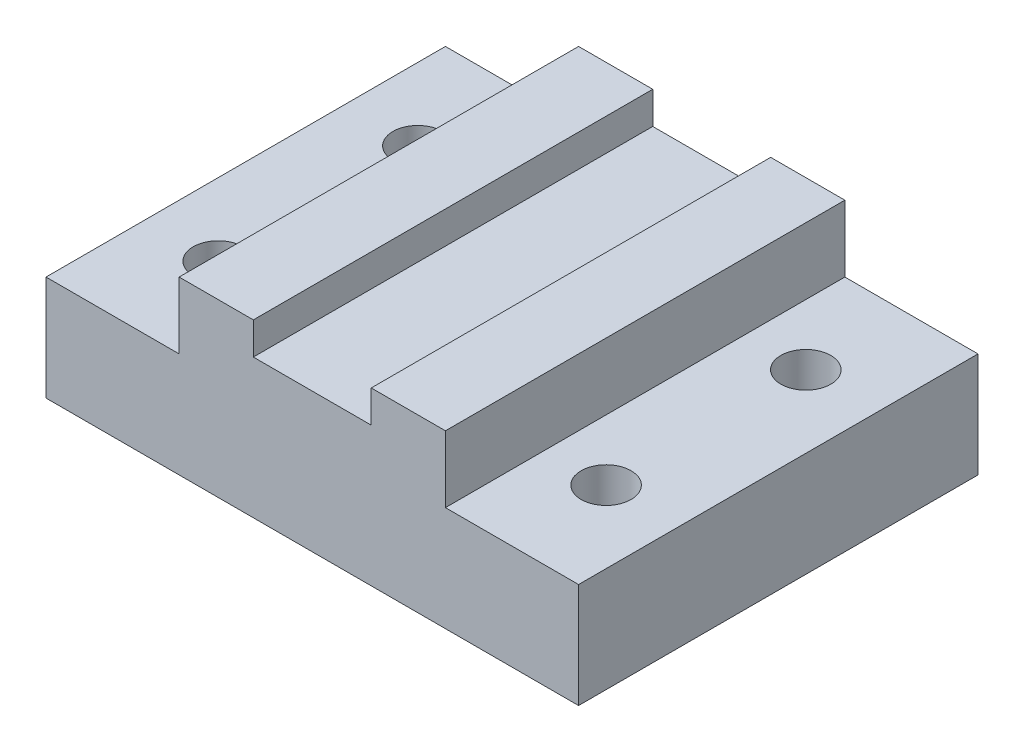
SolidWorks part; units mm, degrees
ref_plane "Front" through (0, 0, 0) normal (0, 0, 1) x (1, 0, 0)
ref_plane "Top" through (0, 0, 0) normal (0, 1, 0) x (1, 0, 0)
ref_plane "Right" through (0, 0, 0) normal (1, 0, 0) x (0, 0, -1)
sketch "Sketch1" plane through (0, 0, 0) normal (0, 0, 1) x (1, 0, 0)
  line L1 (-101.6, 0) -> (101.6, 0)
  line L2 (-101.6, 0) -> (-101.6, 40)
  line L3 (-101.6, 40) -> (101.6, 40)
  line L4 (101.6, 0) -> (101.6, 40)
  point P4 (0, 0)
  dimension "D1" = 203.2
  dimension "D2" = 40
extrude "Extrude1" add sketch "Sketch1" along normal mid plane 152.4
sketch "Sketch3" plane through (0, 40, 0) normal (0, 1, 0) x (-1, 0, 0)
  line L0 (-101.6, 76.2) -> (101.6, 76.2) construction
  line L1 (-50.8, 76.2) -> (50.8, 76.2)
  line L2 (-50.8, 76.2) -> (-50.8, -76.2)
  line L3 (-50.8, -76.2) -> (50.8, -76.2)
  line L4 (50.8, 76.2) -> (50.8, -76.2)
  line L5 (-101.6, -76.2) -> (101.6, -76.2) construction
  point P8 (0, 76.2)
  dimension "D1" = 101.6
extrude "Extrude2" add sketch "Sketch3" along normal blind 25.4
sketch "Sketch4" plane through (0, 40, 0) normal (0, 1, 0) x (-1, 0, 0)
  line L0 (50.8, 76.2) -> (101.6, 76.2) construction
  line L1 (50.8, -76.2) -> (101.6, -76.2) construction
  line L2 (0, 0) -> (0, 86.874) construction
  circle A0 centre (74.0068, 38.1) radius 9.525
  circle A1 centre (74.0068, -38.1) radius 9.525
  circle A2 centre (-74.0068, -38.1) radius 9.525
  circle A3 centre (-74.0068, 38.1) radius 9.525
  dimension "D3" = 19.05
  dimension "D1" = 38.1
  dimension "D2" = 38.1
extrude "Cut-Extrude1" cut sketch "Sketch4" against normal through all
sketch "Sketch5" plane through (0, 0, -76.2) normal (0, 0, -1) x (-1, 0, 0)
  line L0 (-50.8, 65.4) -> (50.8, 65.4) construction
  line L1 (-22.4945, 65.4) -> (22.4945, 65.4)
  line L2 (-22.4945, 65.4) -> (-22.4945, 53.1117)
  line L3 (-22.4945, 53.1117) -> (22.4945, 53.1117)
  line L4 (22.4945, 65.4) -> (22.4945, 53.1117)
  point P6 (0, 53.1117)
extrude "Cut-Extrude2" cut sketch "Sketch5" against normal through all
